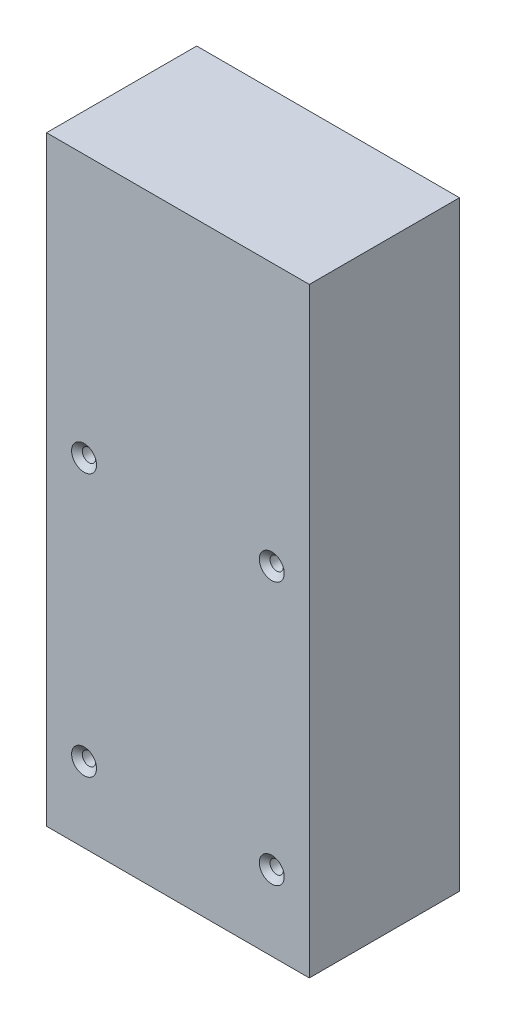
SolidWorks part; units mm, degrees
ref_plane "Front Plane" through (0, 0, 0) normal (0, 0, 1) x (1, 0, 0)
ref_plane "Top Plane" through (0, 0, 0) normal (0, 1, 0) x (1, 0, 0)
ref_plane "Right Plane" through (0, 0, 0) normal (1, 0, 0) x (0, 0, -1)
sketch "Sketch1" plane through (0, 0, 0) normal (0, 1, 0) x (1, 0, 0)
  line L1 (-44.45, 25.4) -> (44.45, 25.4)
  line L2 (-44.45, 25.4) -> (-44.45, -25.4)
  line L3 (-44.45, -25.4) -> (44.45, -25.4)
  line L4 (44.45, 25.4) -> (44.45, -25.4)
  line L5 (-44.45, 25.4) -> (44.45, -25.4) construction
  line L6 (-44.45, -25.4) -> (44.45, 25.4) construction
  point P0 (0, 0)
  dimension "D1" = 88.9
  dimension "D2" = 50.8
extrude "Boss-Extrude1" add sketch "Sketch1" along normal blind 203.2
hole_wizard "CSK for #8 Flat Head Machine Screw (100)1" positions "Sketch3" profile "Sketch2" countersink size "#8" standard "ANSI Inch"
sketch "Sketch3"
  line L0 (-44.45, 0) -> (44.45, 0) construction
  line L1 (44.45, 203.2) -> (44.45, 0) construction
  line L2 (-44.45, 203.2) -> (-44.45, 0) construction
  point P0 (-31.75, 25.4)
  point P2 (31.75, 25.4)
  point P4 (-31.75, 114.3)
  point P6 (31.75, 114.3)
  dimension "D1" = 25.4
  dimension "D2" = 25.4
  dimension "D3" = 114.3
  dimension "D4" = 114.3
  dimension "D5" = 12.7
  dimension "D6" = 12.7
  dimension "D7" = 12.7
  dimension "D8" = 12.7
sketch "Sketch2" plane through (-31.75, 25.4, 25.4) normal (1, 0, 0) x (0, -1, 0)
  line L0 (0, 0) -> (0, 50.8)
  line L1 (0, 50.8) -> (2.2479, 50.8)
  line L2 (2.2479, 50.8) -> (2.2479, 1.6518)
  line L3 (2.2479, 1.6518) -> (4.2164, 0)
  line L5 (4.2164, 0) -> (0, 0)
  line L6 (-2.2479, 1.6518) -> (-4.2164, 0) construction
  line L11 (0, -6.35) -> (0, 107.95) construction
  dimension "Thru Hole Dia." = 4.4958
  dimension "Thru Hole Depth" = 50.8
  dimension "Near C'Sink Dia." = 8.4328
  dimension "Near C'Sink Angle" = 100
hole_wizard "1/4 (0.25) Diameter Hole1" positions "Sketch4" profile "Sketch5" hole size "1/4" standard "ANSI Inch"
sketch "Sketch4" plane through (-1873.5979, -1046.7572, 25.4) normal (0, 0, 1) x (1, 0, 0)
  point P0 (1834.9862, 1129.2666)
  point P3 (1834.9862, 1103.8666)
  point P6 (1892.1362, 1103.8666)
  point P9 (1892.1362, 1129.2666)
  point P12 (2368.3862, 1129.2666)
  point P15 (2368.3862, 1103.8666)
  point P18 (2311.2362, 1129.2666)
  point P21 (2311.2362, 1103.8666)
  point P24 (3327.7479, 1142.0072)
  point P27 (3327.7479, 1116.6072)
  point P30 (3384.8979, 1116.6072)
  point P33 (3384.8979, 1142.0072)
  point P36 (3790.7862, 1103.9072)
  point P39 (3790.7862, 1129.3072)
  point P42 (3847.9362, 1129.3072)
  point P45 (3847.9362, 1103.9072)
sketch "Sketch5" plane through (-28.8309, 82.5094, 25.4) normal (1, 0, 0) x (0, -1, 0)
  line L0 (0, 0) -> (0, 103.5067)
  line L1 (0, 103.5067) -> (3.175, 101.599)
  line L2 (3.175, 101.599) -> (3.175, 0)
  line L3 (3.175, 0) -> (0, 0)
  line L4 (0, 103.5067) -> (-3.175, 101.599) construction
  line L5 (0, -6.35) -> (0, 107.95) construction
  dimension "Hole Dia." = 6.35
  dimension "Hole Depth" = 101.599
  dimension "Drill Angle" = 118
sketch "Sketch8" plane through (0, 69.8094, 25.4) normal (0, 0, -1) x (1, 0, 0)
  line L0 (-38.1, 22.225) -> (38.1, -22.225) construction
  line L1 (-34.1376, 22.225) -> (34.1376, 22.225)
  line L2 (-38.1, 18.2626) -> (-38.1, -18.2626)
  line L3 (-34.1376, -22.225) -> (34.1376, -22.225)
  line L4 (38.1, 18.2626) -> (38.1, -18.2626)
  line L5 (-44.45, -133.3906) -> (-44.45, 69.8094) construction
  line L8 (0, 0) -> (0, 22.225) construction
  line L9 (0, 0) -> (38.1, 0) construction
  circle A0 centre (-28.575, 12.7) radius 3.175
  circle A1 centre (-28.575, -12.7) radius 3.175
  circle A2 centre (28.575, -12.7) radius 3.175
  circle A3 centre (28.575, 12.7) radius 3.175
  arc A4 (-38.1, -18.2626) -> (-34.1376, -22.225) centre (-34.1376, -18.2626) ccw
  arc A5 (34.1376, -22.225) -> (38.1, -18.2626) centre (34.1376, -18.2626) ccw
  arc A6 (34.1376, 22.225) -> (38.1, 18.2626) centre (34.1376, 18.2626) cw
  arc A7 (-34.1376, 22.225) -> (-38.1, 18.2626) centre (-34.1376, 18.2626) ccw
  point P24 (38.1, 22.225)
  dimension "D1" = 6.35
extrude "Cut-Extrude1" [suppressed] cut sketch "Sketch8" along normal through all
